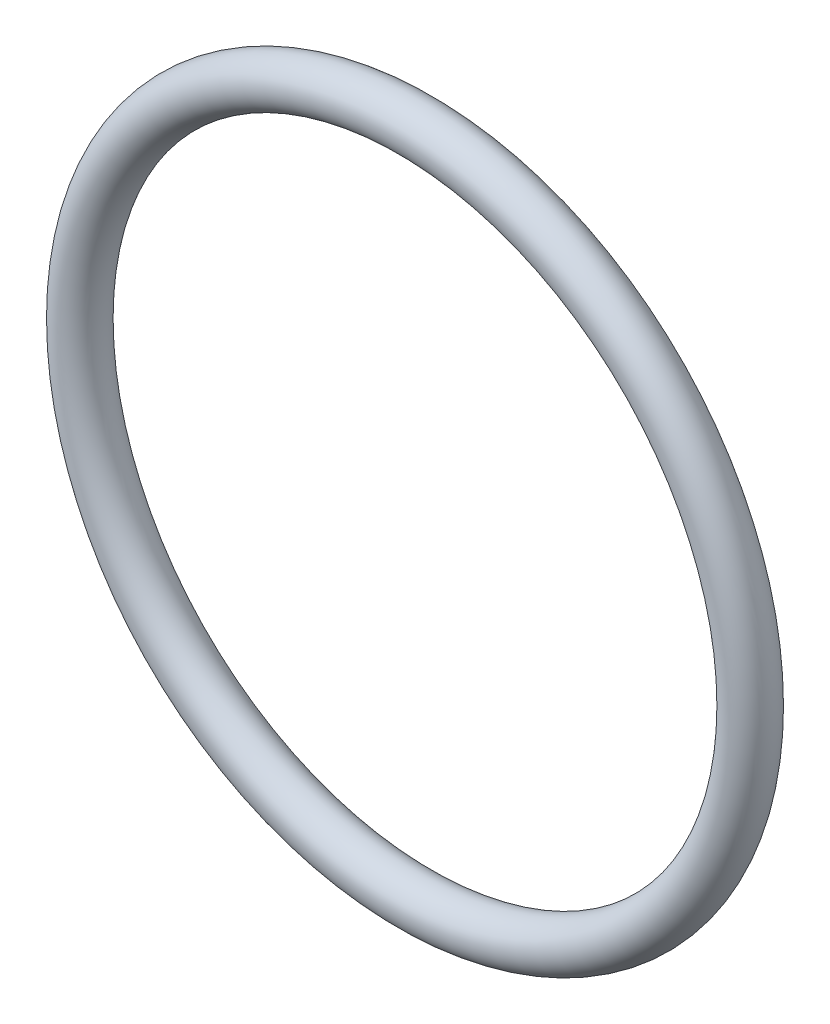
SolidWorks part; units mm, degrees
ref_plane "Front" through (0, 0, 0) normal (0, 0, 1) x (1, 0, 0)
ref_plane "Top" through (0, 0, 0) normal (0, 1, 0) x (1, 0, 0)
ref_plane "Right" through (0, 0, 0) normal (1, 0, 0) x (0, 0, -1)
sketch "Sketch1" plane through (0, 0, 0) normal (1, 0, 0) x (0, -1, 0)
  line L0 (0, -0.889) -> (0, 0.889) construction
  line L2 (-14.892, 0) -> (14.892, 0) construction
  line L3 (-11.7602, 0) -> (11.7602, 0) construction
  circle A0 centre (12.6492, 0) radius 0.889
  point P9 (11.7602, 0)
  point P10 (13.5382, 0)
  point P13 (12.6492, 0.889)
  point P14 (12.6492, -0.889)
  dimension "Width" = 1.778
  dimension "ID" = 23.5204
revolve "Revolve1" add sketch "Sketch1" angle 360 about L0
